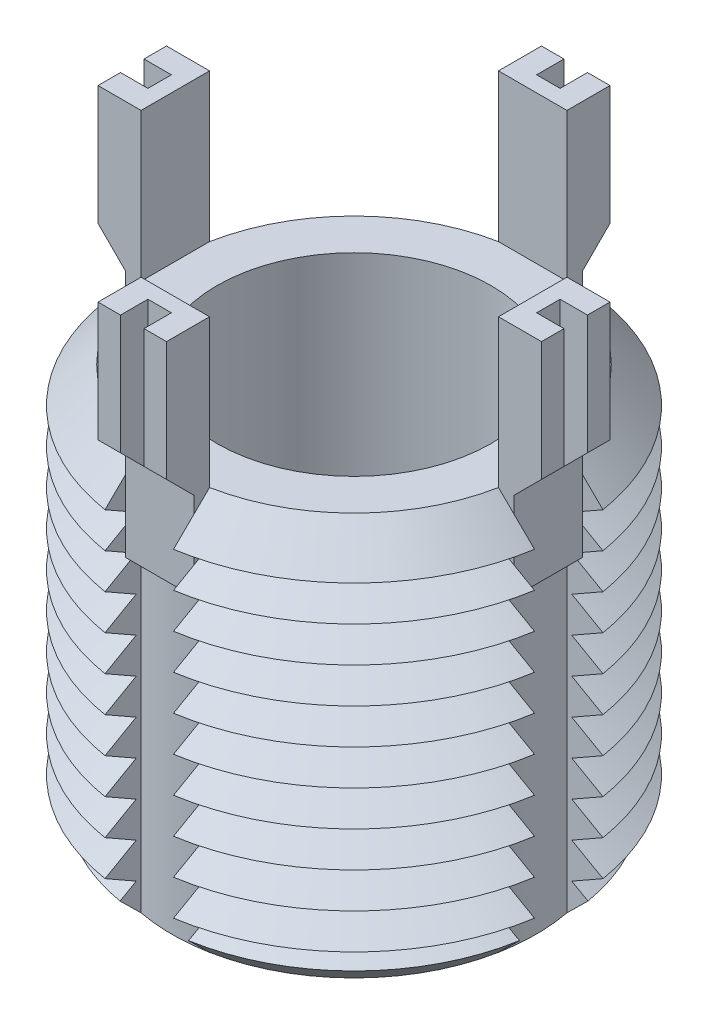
SolidWorks part; units mm, degrees
ref_plane "Front Plane" through (0, 0, 0) normal (0, 0, 1) x (1, 0, 0)
ref_plane "Top Plane" through (0, 0, 0) normal (0, 1, 0) x (1, 0, 0)
ref_plane "Right Plane" through (0, 0, 0) normal (1, 0, 0) x (0, 0, -1)
sketch "Sketch1" plane through (0, 0, 0) normal (0, 1, 0) x (1, 0, 0)
  circle A0 centre (0, 0) radius 11.1125
  dimension "D1" = 22.225
extrude "Boss-Extrude1" add sketch "Sketch1" against normal blind 20.574
chamfer "Chamfer1" distance 1.814 angle 45 2 edges at (0, -20.574, 11.1125) (0, 0, 11.1125)
sketch "Sketch2" plane through (0, 0, 0) normal (1, 0, 0) x (0, 0, -1)
  line L0 (0, 0.8859) -> (0, -9.2617) construction
sketch "Sketch3" plane through (0, 0, 0) normal (1, 0, 0) x (0, 0, -1)
  line L0 (-11.1125, -1.814) -> (-9.5415, -2.721)
  line L1 (-9.5415, -2.721) -> (-11.1125, -3.628)
  line L2 (-11.1125, -1.814) -> (-11.1125, -18.76) construction
  line L3 (-11.1125, -3.628) -> (-11.1125, -1.814)
  dimension "D1" = 1.814
revolve "Cut-Revolve1" cut sketch "Sketch3" angle 360 about L0
pattern_linear "LPattern1" count 10 spacing 1.814 along (0, -1, 0) of "Cut-Revolve1"
sketch "Sketch4" plane through (0, 0, 0) normal (0, 1, 0) x (1, 0, 0)
  line L0 (-9.1323, 1.75) -> (-10.9738, 1.75)
  line L2 (-10.9738, -1.75) -> (-9.1323, -1.75)
  arc A0 (-9.1323, 1.75) -> (-9.1323, -1.75) centre (0, 0) ccw
  arc A1 (-10.9738, 1.75) -> (-10.9738, -1.75) centre (0, 0) ccw
  circle A2 centre (0, 0) radius 11.1125 construction
  circle A3 centre (0, 0) radius 9.2985 construction
  point P1 (-9.2985, 0)
  point P3 (-11.1125, 0)
  point P13 (0, 0)
  dimension "D1" = 3.5
extrude "Cut-Extrude1" cut sketch "Sketch4" against normal up to surface (20.574 mm away)
pattern_circular "CirPattern1" count 4 over 360 about axis through (0, 0, 0) along (0, 1, 0) of "Cut-Extrude1"
sketch "Sketch5" plane through (0, 0, 0) normal (1, 0, 0) x (0, 0, -1)
  line L0 (-9.1323, 7.558) -> (-9.1323, -4.442)
  line L1 (-9.1323, -4.442) -> (-9.9323, -4.442)
  line L2 (-9.9323, -4.442) -> (-9.9323, 0.058)
  line L3 (-9.9323, 0.058) -> (-11.3323, 1.458)
  line L4 (-11.3323, 1.458) -> (-11.3323, 7.558)
  line L5 (-11.3323, 7.558) -> (-9.1323, 7.558)
  line L6 (-10.9738, -5.442) -> (-1.75, -5.442) construction
  point P9 (-1.75, 0)
  point P10 (-9.9323, 0.058)
  dimension "D1" = 1
  dimension "D2" = 12
  dimension "D3" = 7.5
  dimension "D4" = 2.2
  dimension "D5" = 0.8
  dimension "D6" = 45
extrude "Boss-Extrude3" add sketch "Sketch5" along normal mid plane 3.5
pattern_circular "CirPattern2" count 4 over 360 about axis through (0, 0, 0) along (0, 1, 0) of "Boss-Extrude3"
sketch "Sketch6" plane through (0, 7.558, 0) normal (0, 1, 0) x (1, 0, 0)
  line L0 (-11.3323, -1.75) -> (-11.3323, 1.75) construction
  line L1 (-11.3323, -0.6) -> (-9.9323, -0.6)
  line L2 (-11.3323, -0.6) -> (-11.3323, 0.6)
  line L3 (-11.3323, 0.6) -> (-9.9323, 0.6)
  line L4 (-9.9323, -0.6) -> (-9.9323, 0.6)
  line L5 (-11.3323, -0.6) -> (-9.9323, 0.6) construction
  line L6 (-11.3323, 0.6) -> (-9.9323, -0.6) construction
  line L7 (11.3323, 1.75) -> (11.3323, -1.75) construction
  line L8 (-0.6, 9.9323) -> (0.6, 9.9323)
  line L9 (-0.6, 9.9323) -> (-0.6, 11.3323)
  line L10 (-0.6, 11.3323) -> (0.6, 11.3323)
  line L11 (0.6, 9.9323) -> (0.6, 11.3323)
  line L12 (-0.6, 9.9323) -> (0.6, 11.3323) construction
  line L13 (-0.6, 11.3323) -> (0.6, 9.9323) construction
  line L14 (9.9323, -0.6) -> (11.3323, -0.6)
  line L15 (9.9323, -0.6) -> (9.9323, 0.6)
  line L16 (9.9323, 0.6) -> (11.3323, 0.6)
  line L17 (11.3323, -0.6) -> (11.3323, 0.6)
  line L18 (9.9323, -0.6) -> (11.3323, 0.6) construction
  line L19 (9.9323, 0.6) -> (11.3323, -0.6) construction
  line L20 (-0.6, -11.3323) -> (0.6, -11.3323)
  line L21 (-0.6, -11.3323) -> (-0.6, -9.9323)
  line L22 (-0.6, -9.9323) -> (0.6, -9.9323)
  line L23 (0.6, -11.3323) -> (0.6, -9.9323)
  line L24 (-0.6, -11.3323) -> (0.6, -9.9323) construction
  line L25 (-0.6, -9.9323) -> (0.6, -11.3323) construction
  line L26 (-1.75, 11.3323) -> (1.75, 11.3323) construction
  line L27 (1.75, -11.3323) -> (-1.75, -11.3323) construction
  point P0 (-10.6323, 0)
  point P7 (-11.3323, 0)
  point P8 (-11.3323, 0)
  point P9 (0, 10.6323)
  point P14 (10.6323, 0)
  point P19 (0, -10.6323)
  point P24 (0, 11.3323)
  point P25 (11.3323, 0)
  point P26 (11.3323, 0)
  point P27 (0, 11.3323)
  point P30 (0, -11.3323)
  point P33 (0, -11.3323)
  dimension "D1" = 1.2
  dimension "D2" = 1.4
extrude "Cut-Extrude3" cut sketch "Sketch6" against normal up to surface (6.1 mm away)
sketch "Sketch7" plane through (0, 0, 0) normal (0, 1, 0) x (1, 0, 0)
  circle A0 centre (0, 0) radius 7
  dimension "D1" = 14
extrude "Cut-Extrude4" cut sketch "Sketch7" against normal up to surface (20.574 mm away)
